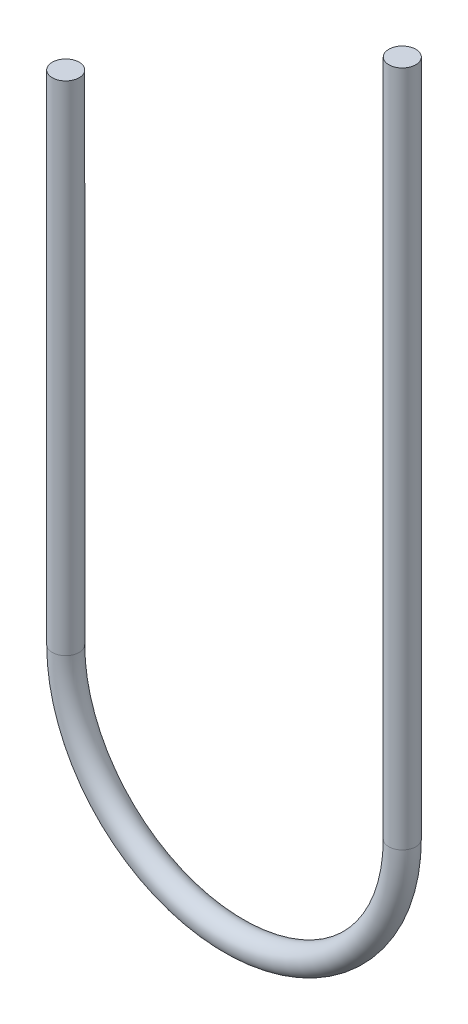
SolidWorks part; units mm, degrees
ref_plane "Front Plane" through (0, 0, 0) normal (0, 0, 1) x (1, 0, 0)
ref_plane "Top Plane" through (0, 0, 0) normal (0, 1, 0) x (1, 0, 0)
ref_plane "Right Plane" through (0, 0, 0) normal (1, 0, 0) x (0, 0, -1)
sketch "Sketch1" plane through (0, 0, 0) normal (0, 0, 1) x (1, 0, 0)
  line L0 (-57.15, -88.9) -> (-57.15, -229.772)
  line L1 (38.1, -38.1) -> (38.1, -229.772)
  arc A0 (38.1, -229.772) -> (-57.15, -229.772) centre (-9.525, -229.772) cw
sketch "Sketch2" plane through (0, -38.1, 0) normal (0, -1, 0) x (1, 0, 0)
  circle A1 centre (38.1, 0) radius 3.81
sweep "Sweep1" add profiles "Sketch2" path "Sketch1"
